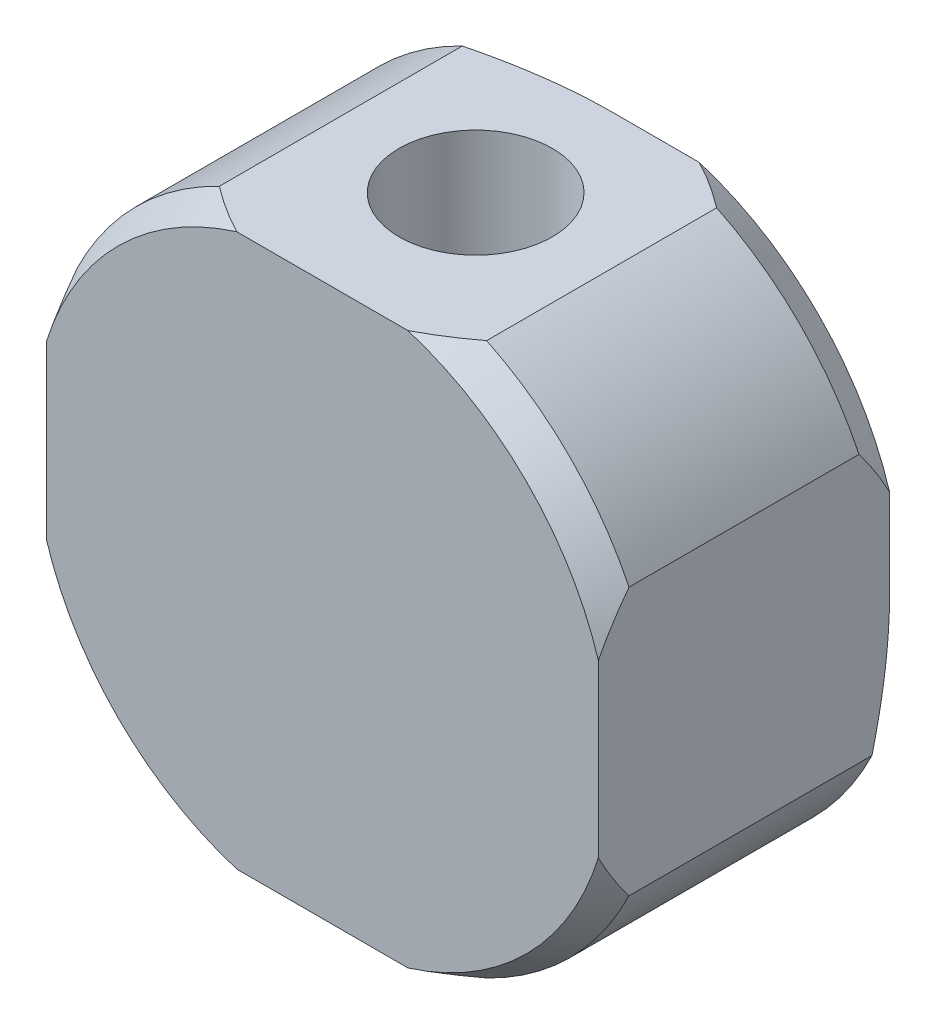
SolidWorks part; units mm, degrees
ref_plane "Plane1" through (0, 0, 0) normal (0, 0, 1) x (1, 0, 0)
ref_plane "Plane2" through (0, 0, 0) normal (0, 1, 0) x (1, 0, 0)
ref_plane "Plane3" through (0, 0, 0) normal (1, 0, 0) x (0, 0, -1)
sketch "Sketch1" plane through (0, 0, 0) normal (0, 0, 1) x (1, 0, 0)
  line L0 (0, 9) -> (0, -9) construction
  line L1 (-4.3589, 9) -> (4.3589, 9)
  line L2 (-9, 4.3589) -> (-9, -4.3589)
  line L3 (-4.3589, -9) -> (4.3589, -9)
  line L4 (9, 4.3589) -> (9, -4.3589)
  line L5 (9, 0) -> (-9, 0) construction
  arc A0 (-9, -4.3589) -> (-4.3589, -9) centre (0, 0) ccw
  arc A1 (-4.3589, 9) -> (-9, 4.3589) centre (0, 0) ccw
  arc A2 (9, 4.3589) -> (4.3589, 9) centre (0, 0) ccw
  arc A3 (4.3589, -9) -> (9, -4.3589) centre (0, 0) ccw
  dimension "C" = 20
  dimension "B" = 18
extrude "Base-Extrude" add sketch "Sketch1" along normal blind 9.5
sketch "Sketch2" plane through (0, 9, 0) normal (0, 1, 0) x (-1, 0, 0)
  line L1 (0, 50) -> (0, -50) construction
  line L2 (-4.3589, 9.5) -> (4.3589, 9.5) construction
  circle A0 centre (0, 4.5) radius 2.5
  dimension "P" = 5
  dimension "GB" = 5
extrude "Port" cut sketch "Sketch2" against normal blind 5
chamfer "Chamfer1" distance 1 angle 30
